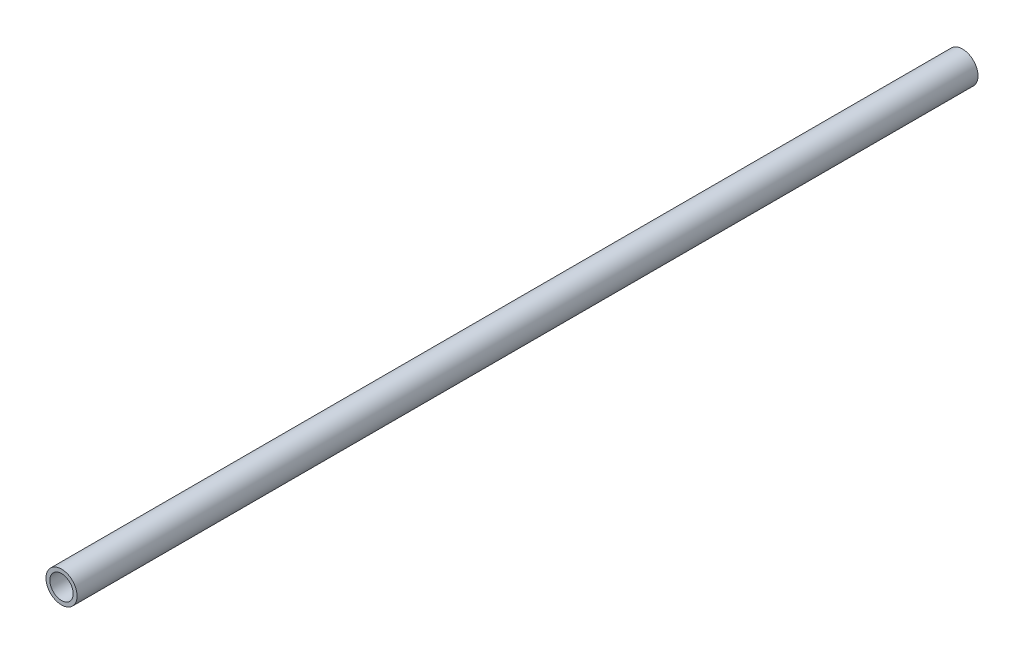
SolidWorks part; units mm, degrees
ref_plane "Front" through (0, 0, 0) normal (0, 0, 1) x (1, 0, 0)
ref_plane "Top" through (0, 0, 0) normal (0, 1, 0) x (1, 0, 0)
ref_plane "Right" through (0, 0, 0) normal (1, 0, 0) x (0, 0, -1)
sketch "Esquisse1" plane through (0, 0, 0) normal (0, 0, 1) x (1, 0, 0)
  circle A0 centre (0, 0) radius 10
  circle A1 centre (0, 0) radius 7.5
  dimension "D1" = 20
  dimension "D2" = 2.5
extrude "Boss.-Extru.1" add sketch "Esquisse1" along normal blind 579
ref_plane "Plan1" through (0, 0, 289.5) normal (0, 0, 1) x (1, 0, 0)
